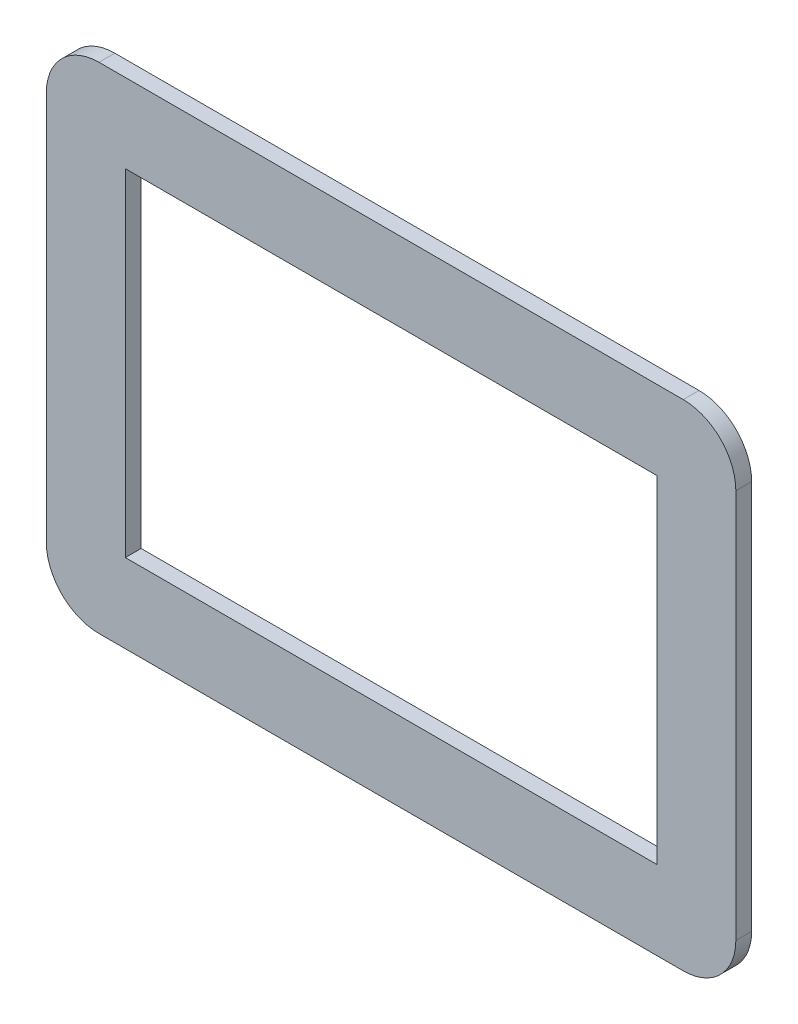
SolidWorks part; units mm, degrees
ref_plane "Plan de face" through (0, 0, 0) normal (0, 0, 1) x (1, 0, 0)
ref_plane "Plan de dessus" through (0, 0, 0) normal (0, 1, 0) x (1, 0, 0)
ref_plane "Plan de droite" through (0, 0, 0) normal (1, 0, 0) x (0, 0, -1)
sketch "Esquisse1" plane through (0, 0, 0) normal (0, 0, 1) x (1, 0, 0)
  line L1 (-111, 94) -> (111, 94)
  line L2 (-131, 74) -> (-131, -74)
  line L3 (-111, -94) -> (111, -94)
  line L4 (131, 74) -> (131, -74)
  arc A0 (-111, 94) -> (-131, 74) centre (-111, 74) ccw
  arc A1 (111, 94) -> (131, 74) centre (111, 74) cw
  arc A2 (111, -94) -> (131, -74) centre (111, -74) ccw
  arc A3 (-131, -74) -> (-111, -94) centre (-111, -74) ccw
  point P6 (-131, 94)
  point P9 (131, 94)
  point P14 (-131, -94)
  dimension "D5" = 20
  dimension "D1" = 262
  dimension "D2" = 188
  dimension "D3" = 94
  dimension "D4" = 131
extrude "Extru.-Mince1" add sketch "Esquisse1" along normal blind 6 thin
